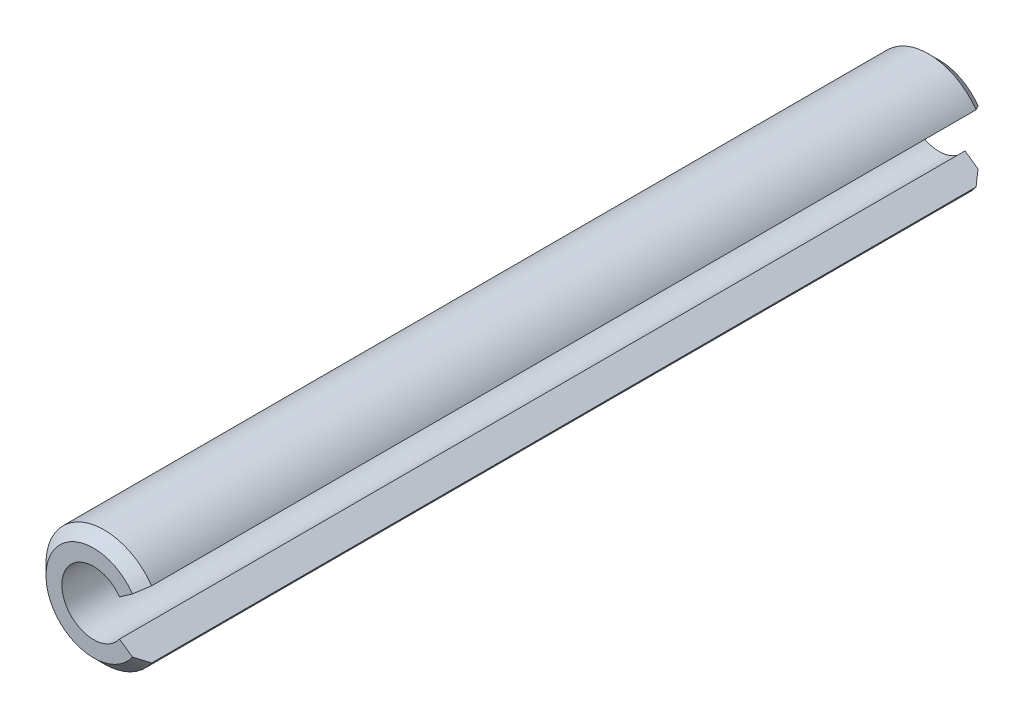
SolidWorks part; units mm, degrees
ref_plane "Plan de face" through (0, 0, 0) normal (0, 0, 1) x (1, 0, 0)
ref_plane "Plan de dessus" through (0, 0, 0) normal (0, 1, 0) x (1, 0, 0)
ref_plane "Plan de droite" through (0, 0, 0) normal (1, 0, 0) x (0, 0, -1)
sketch "Esquisse1" plane through (0, 0, 0) normal (0, 0, 1) x (1, 0, 0)
  line L0 (0.9, 0.6325) -> (0.9, -0.6325) construction
  line L1 (-1.1, 0) -> (0.9, 0) construction
  line L2 (0, 0) -> (0.9, 0.6325) construction
  line L3 (0, 0) -> (0.9, -0.6325) construction
  line L4 (0.9, -0.6325) -> (0.4909, -0.345)
  line L5 (0.9, 0.6325) -> (0.4909, 0.345)
  arc A0 (0.9, 0.6325) -> (0.9, -0.6325) centre (0, 0) ccw
  arc A1 (0.4909, 0.345) -> (0.4909, -0.345) centre (0, 0) ccw
  dimension "D1" = 2.2
  dimension "D2" = 0.5
  dimension "D3" = 2
extrude "Extrusion1" add sketch "Esquisse1" along normal blind 16
chamfer "Chanfrein1" distance 0.2 angle 45 2 edges at (-1.1, 0, 0) (-1.1, 0, 16)
